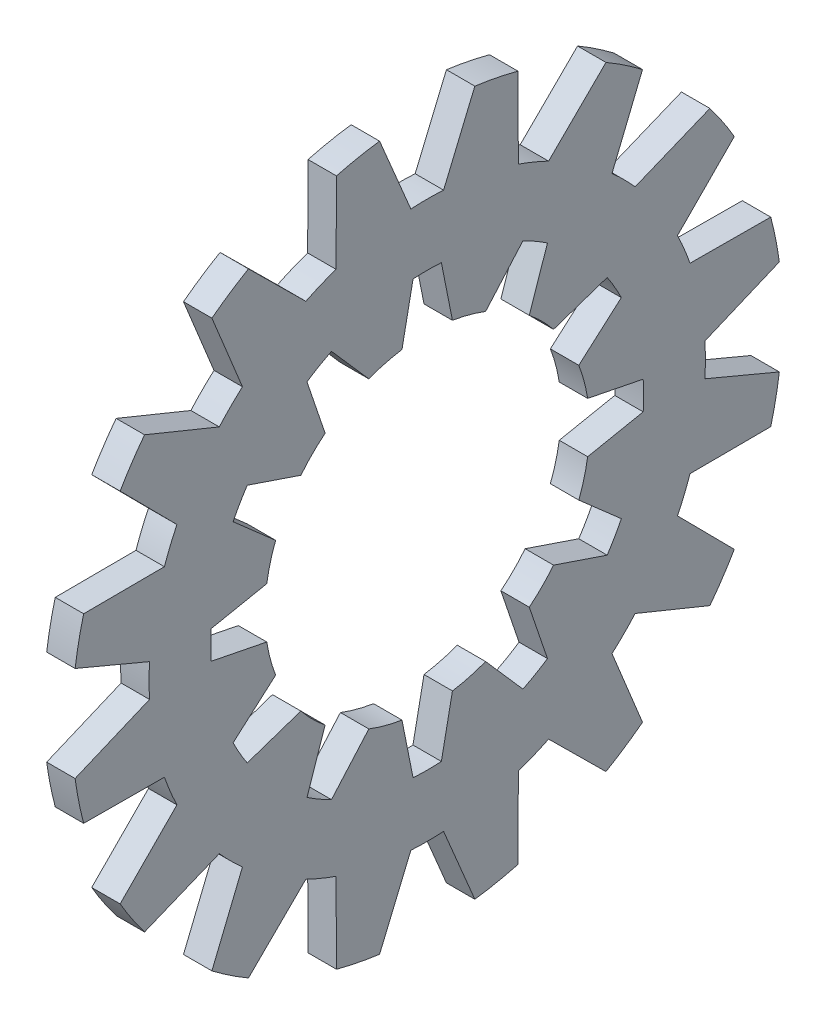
SolidWorks part; units mm, degrees
ref_plane "Plane1" through (0, 0, 0) normal (0, 0, 1) x (1, 0, 0)
ref_plane "Plane2" through (0, 0, 0) normal (0, 1, 0) x (1, 0, 0)
ref_plane "Plane3" through (0, 0, 0) normal (1, 0, 0) x (0, 0, -1)
sketch "SecSke" plane through (0, 0, 0) normal (0, 0, 1) x (1, 0, 0)
  line L0 (-34.925, 0) -> (9.525, 0) construction
  line L1 (0, 8) -> (0, 17.5)
  line L2 (0, 17.5) -> (-1.4, 17.5)
  line L3 (-1.4, 17.5) -> (-1.4, 8)
  line L4 (-1.4, 8) -> (0, 8)
  dimension "Thickness" = 1.4
  dimension "Inside_dia" = 16
  dimension "Outside_dia" = 35
revolve "Body" add sketch "SecSke" angle 360 about L0
sketch "ExtCutSke" plane through (0, 0, 0) normal (1, 0, 0) x (0, 0, -1)
  line L0 (0, 0) -> (0, 18.375) construction
  line L1 (-2.6962, 18.1761) -> (-0.8065, 13.6762)
  line L2 (2.6962, 18.1761) -> (0.8065, 13.6762)
  arc A0 (2.6962, 18.1761) -> (-2.6962, 18.1761) centre (0, 0) ccw
  arc A1 (0.8065, 13.6762) -> (-0.8065, 13.6762) centre (0, 0) ccw
  dimension "Cut_dia" = 27.4
  dimension "Clr_dia" = 36.75
  dimension "Cut_ang" = 6.75
  dimension "Clr_ang" = 16.875
extrude "ExtCut" cut sketch "ExtCutSke" against normal through all
pattern_circular "ExtCuts" count 16 every 22.5 about axis through (-34.925, 0, 0) along (1, 0, 0) of "ExtCut"
sketch "IntCutSke" plane through (0, 0, 0) normal (1, 0, 0) x (0, 0, -1)
  line L0 (-0.6972, 10.6372) -> (-1.3263, 7.4834)
  line L1 (0.6972, 10.6372) -> (1.3263, 7.4834)
  line L2 (0, 0) -> (0, 10.66) construction
  arc A0 (1.3263, 7.4834) -> (-1.3263, 7.4834) centre (0, 0) ccw
  arc A1 (0.6972, 10.6372) -> (-0.6972, 10.6372) centre (0, 0) ccw
  dimension "cut_dia" = 21.32
  dimension "Clr_dia" = 15.2
  dimension "Clr_ang" = 20.1
  dimension "Cut_ang" = 7.5
extrude "IntCut" cut sketch "IntCutSke" against normal through all
pattern_circular "IntCuts" count 12 every 30 about axis through (-34.925, 0, 0) along (1, 0, 0) of "IntCut"
equation "' \"Inside_dia@SecSke\" = 16"
equation "' \"Outside_dia@SecSke\" = 35"
equation "' \"Thickness@SecSke\" = 1.4"
equation "' \"Count@ExtCuts\" = 16"
equation "' \"Count@IntCuts\" = 12"
equation "' \"Inside_dia@SecSke\" = 10.5"
equation "' \"Outside_dia@SecSke\" = 26"
equation "' \"Thickness@SecSke\" = 1"
equation "' \"Count@ExtCuts\" = 14"
equation "' \"Count@IntCuts\" = 9"
equation "' \"Inside_dia@SecSke\" = 6.4"
equation "' \"Outside_dia@SecSke\" = 17.5"
equation "' \"Thickness@SecSke\" = 0.8"
equation "' \"Count@ExtCuts\" = 12"
equation "' \"Inside_dia@SecSke\" = 4.3"
equation "' \"Outside_dia@SecSke\" = 15"
equation "' \"Thickness@SecSke\" = 0.6"
equation "' \"Count@IntCuts\" = 8"
equation "\"Angle@ExtCuts\" = 360 / \"Count@ExtCuts\""
equation "\"Clr_dia@ExtCutSke\" =  \"Outside_dia@SecSke\" * 1.05"
equation "\"Cut_dia@ExtCutSke\" = \"Outside_dia@SecSke\" - (\"Outside_dia@SecSke\"  - \"Inside_dia@SecSke\" ) * 0.4"
equation "\"Clr_ang@ExtCutSke\" = (360 / \"Count@ExtCuts\") * 0.75"
equation "\"Cut_ang@ExtCutSke\" = (360 / \"Count@ExtCuts\") * 0.3"
equation "\"Angle@IntCuts\" = 360 / \"Count@IntCuts\""
equation "\"Clr_dia@IntCutSke\" =  \"Inside_dia@SecSke\" * 0.95"
equation "\"Cut_dia@IntCutSke\" = \"Inside_dia@SecSke\" + (\"Outside_dia@SecSke\"  - \"Inside_dia@SecSke\" ) * 0.28"
equation "\"Clr_ang@IntCutSke\" = (360 / \"Count@IntCuts\") * 0.67"
equation "\"Cut_ang@IntCutSke\" = (360 / \"Count@IntCuts\") * 0.25"
